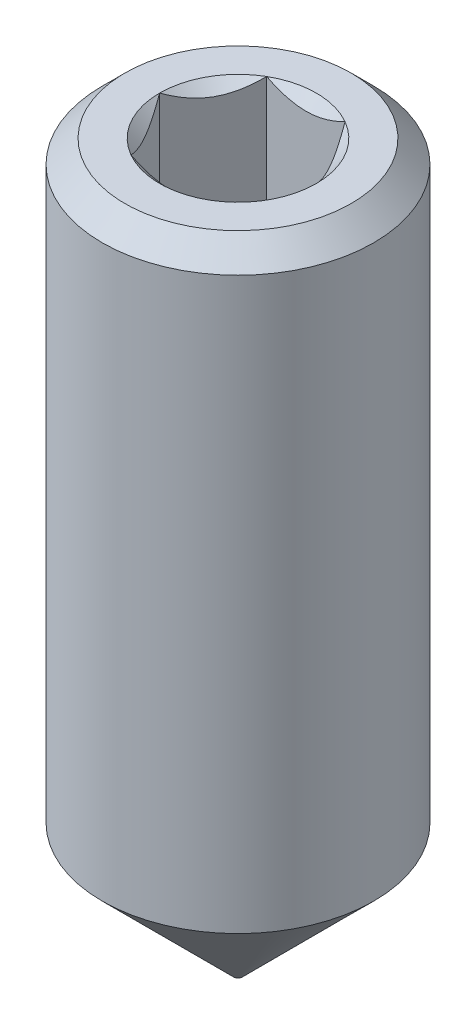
SolidWorks part; units mm, degrees
ref_plane "Plan de face" through (0, 0, 0) normal (0, 0, 1) x (1, 0, 0)
ref_plane "Plan de dessus" through (0, 0, 0) normal (0, 1, 0) x (1, 0, 0)
ref_plane "Plan de droite" through (0, 0, 0) normal (1, 0, 0) x (0, 0, -1)
sketch "Esquisse1" plane through (0, 0, 0) normal (0, 0, 1) x (1, 0, 0)
  line L0 (0, 8) -> (1.25, 8)
  line L1 (1.25, 8) -> (1.5, 7.75)
  line L2 (1.5, 7.75) -> (1.5, 1.45)
  line L3 (1.5, 1.45) -> (0.05, 0)
  line L4 (0.05, 0) -> (0, 0)
  line L5 (0, 0) -> (0, 8) construction
  line L6 (0, 0) -> (0, 8)
  dimension "D1" = 45
  dimension "D2" = 45
  dimension "D3" = 3
  dimension "D4" = 0.25
  dimension "D5" = 0.1
  dimension "D6" = 8
revolve "Révolution1" add sketch "Esquisse1" angle 360 about L5
sketch "Esquisse2" plane through (0, 8, 0) normal (0, 1, 0) x (0, 0, 1)
  line L1 (0.75, 0.433) -> (0, 0.866)
  line L2 (0, 0.866) -> (-0.75, 0.433)
  line L3 (-0.75, 0.433) -> (-0.75, -0.433)
  line L4 (-0.75, -0.433) -> (0, -0.866)
  line L5 (0, -0.866) -> (0.75, -0.433)
  line L6 (0.75, -0.433) -> (0.75, 0.433)
  circle A0 centre (0, 0) radius 0.75 construction
  dimension "D1" = 1.5
extrude "Enlèv. mat.-Extru.1" cut sketch "Esquisse2" against normal blind 1.5
sketch "Esquisse3" plane through (0, 8, 0) normal (0, 1, 0) x (0, 0, 1)
  circle A0 centre (0, 0) radius 0.866
extrude "Enlèv. mat.-Extru.2" cut sketch "Esquisse3" against normal through all draft 45
